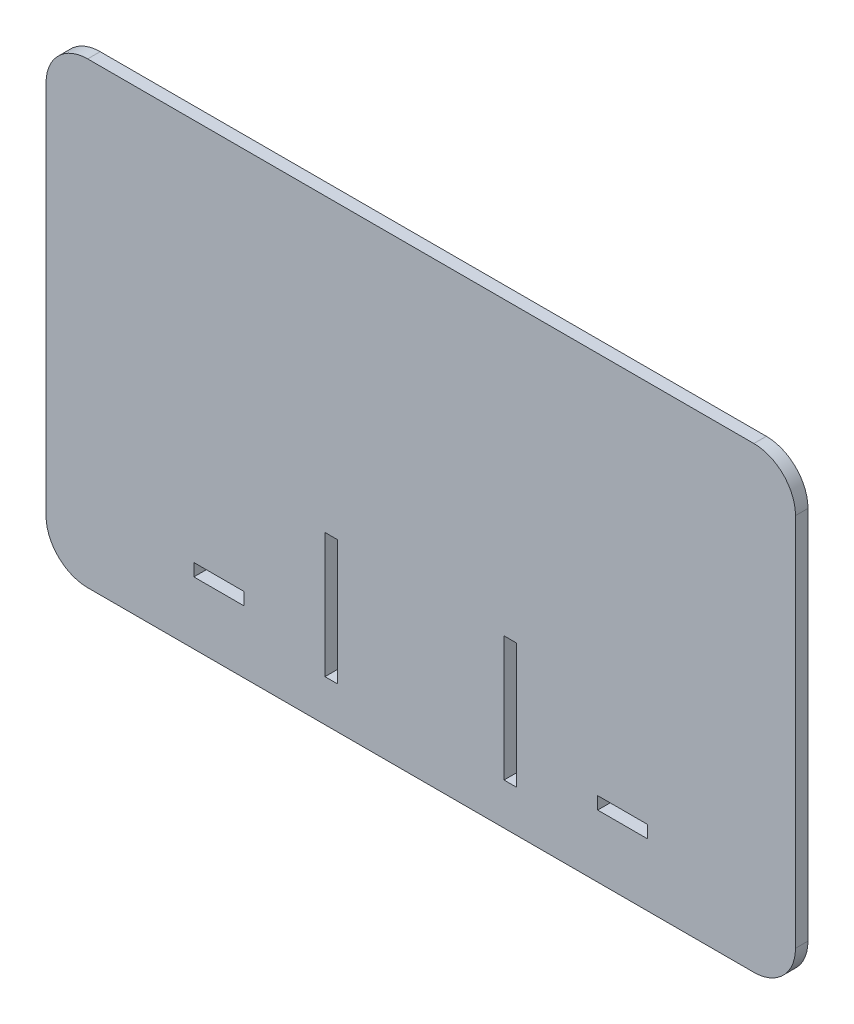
SolidWorks part; units mm, degrees
ref_plane "Plan de face" through (0, 0, 0) normal (0, 0, 1) x (1, 0, 0)
ref_plane "Plan de dessus" through (0, 0, 0) normal (0, 1, 0) x (1, 0, 0)
ref_plane "Plan de droite" through (0, 0, 0) normal (1, 0, 0) x (0, 0, -1)
sketch "Esquisse1" plane through (0, 0, 0) normal (0, 0, 1) x (1, 0, 0)
  line L0 (21.5834, -83.8599) -> (21.5834, 65.5663) construction
  line L1 (-58.4166, 26.1401) -> (101.5834, 26.1401)
  line L2 (-68.4166, 16.1401) -> (-68.4166, -73.8599)
  line L3 (-58.4166, -83.8599) -> (101.5834, -83.8599)
  line L4 (111.5834, 16.1401) -> (111.5834, -73.8599)
  line L5 (41.5834, -73.8599) -> (44.5834, -73.8599)
  line L6 (1.5834, -73.8599) -> (-1.4166, -73.8599)
  line L7 (1.5834, -73.8599) -> (1.5834, -43.8599)
  line L8 (1.5834, -43.8599) -> (-1.4166, -43.8599)
  line L9 (-1.4166, -73.8599) -> (-1.4166, -43.8599)
  line L10 (44.5834, -73.8599) -> (44.5834, -43.8599)
  line L11 (41.5834, -43.8599) -> (44.5834, -43.8599)
  line L12 (41.5834, -73.8599) -> (41.5834, -43.8599)
  line L13 (76.0834, -65.8599) -> (76.0834, -68.8599)
  line L14 (-32.9166, -65.8599) -> (-20.9166, -65.8599)
  line L15 (-32.9166, -65.8599) -> (-32.9166, -68.8599)
  line L16 (-32.9166, -68.8599) -> (-20.9166, -68.8599)
  line L17 (-20.9166, -65.8599) -> (-20.9166, -68.8599)
  line L18 (76.0834, -68.8599) -> (64.0834, -68.8599)
  line L19 (64.0834, -65.8599) -> (64.0834, -68.8599)
  line L20 (76.0834, -65.8599) -> (64.0834, -65.8599)
  arc A0 (-68.4166, -73.8599) -> (-58.4166, -83.8599) centre (-58.4166, -73.8599) ccw
  arc A1 (101.5834, -83.8599) -> (111.5834, -73.8599) centre (101.5834, -73.8599) ccw
  arc A2 (111.5834, 16.1401) -> (101.5834, 26.1401) centre (101.5834, 16.1401) ccw
  arc A3 (-68.4166, 16.1401) -> (-58.4166, 26.1401) centre (-58.4166, 16.1401) cw
  point P16 (-68.4166, -83.8599)
  point P19 (111.5834, -83.8599)
  point P24 (-68.4166, 26.1401)
  dimension "D7" = 10
  dimension "D1" = 180
  dimension "D2" = 110
  dimension "D3" = 3
  dimension "D4" = 30
  dimension "D5" = 10
  dimension "D6" = 20
  dimension "D8" = 3
  dimension "D9" = 12
  dimension "D10" = 42.5
  dimension "D11" = 15
extrude "Boss.-Extru.1" add sketch "Esquisse1" along normal blind 3
